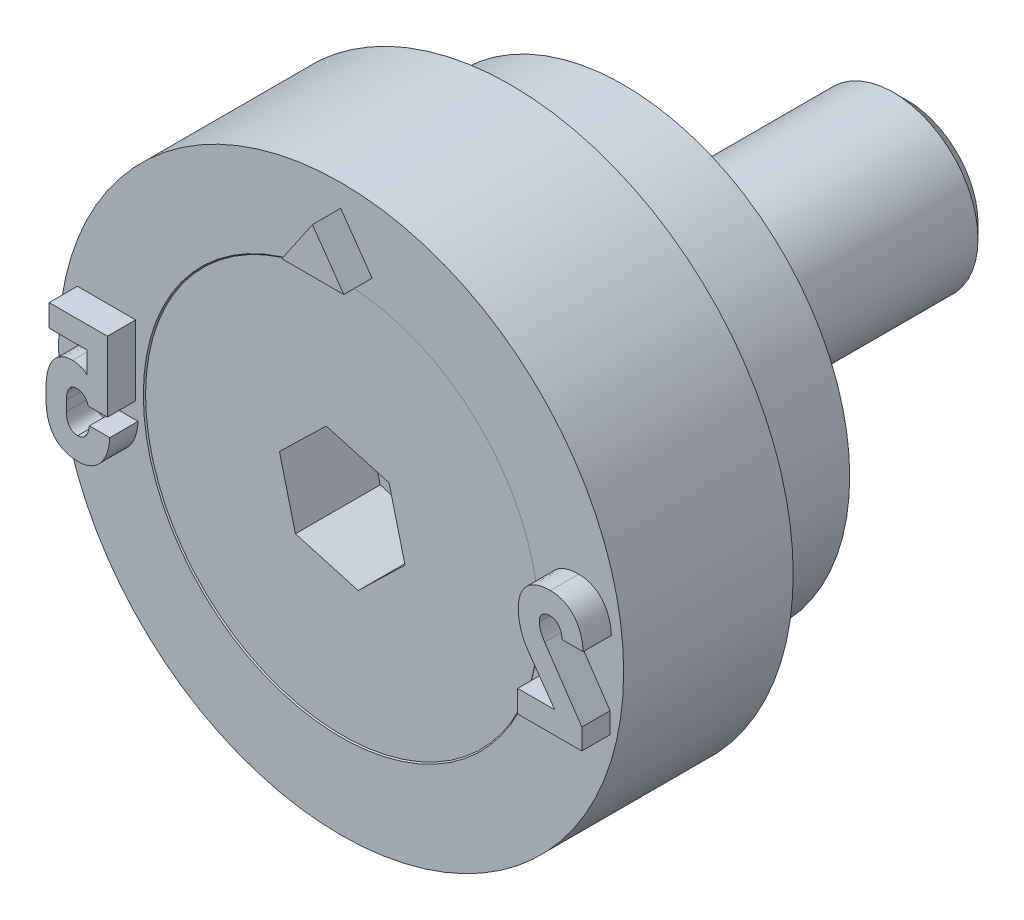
SolidWorks part; units mm, degrees
other "<M3 X .5 FHCS>-<Imported1>"
ref_plane "Front Plane" through (0, 0, 0) normal (0, 0, 1) x (1, 0, 0)
ref_plane "Top Plane" through (0, 0, 0) normal (0, 1, 0) x (1, 0, 0)
ref_plane "Right Plane" through (0, 0, 0) normal (1, 0, 0) x (0, 0, -1)
imported_body "Imported1"
sketch "Sketch1" plane through (0, 0, 0) normal (0, 0, 1) x (1, 0, 0)
  line L0 (-0.0071, 4.6037) -> (-0.5487, 3.81)
  line L1 (-0.5487, 3.81) -> (0.5487, 3.81)
  line L2 (0.5487, 3.81) -> (-0.0071, 4.6037)
  text T0 "2             5" font "Bahnschrift" height 2.159
  dimension "D1" = 1.0795
  dimension "D2" = 4.9022
extrude "Boss-Extrude1" add sketch "Sketch1" along normal blind 0.5 and the other way up to surface
inserted part "M3 X .5 FHCS"
move or copy body "Body-Move/Copy2" placed by mates yes
